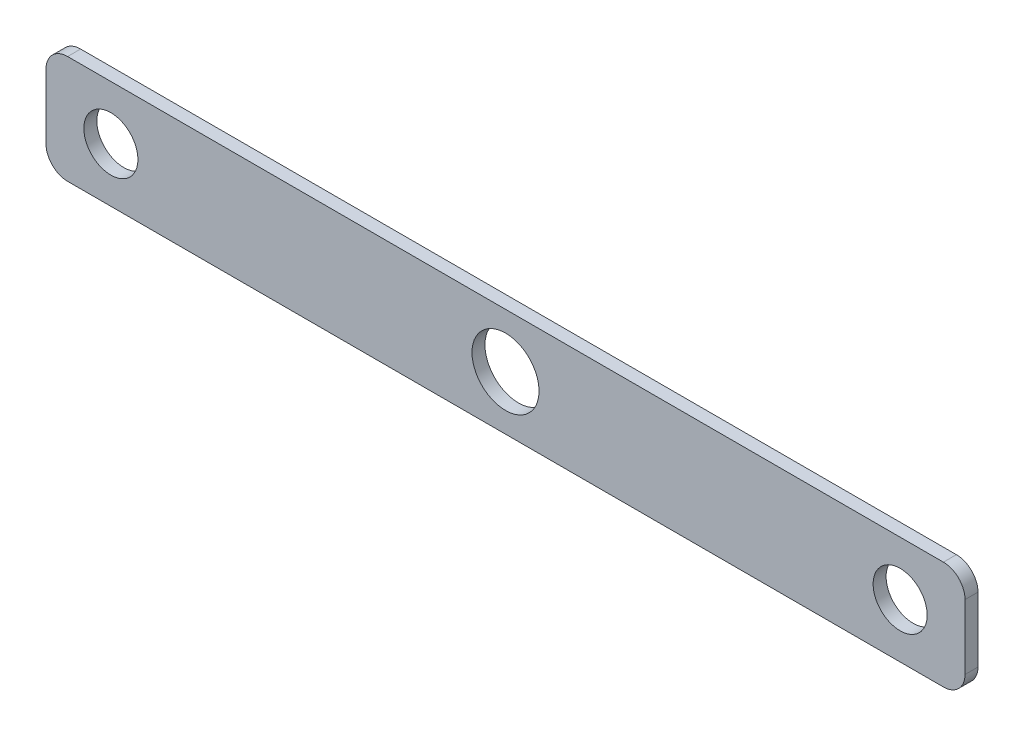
SolidWorks part; units mm, degrees
ref_plane "Front Plane" through (0, 0, 0) normal (0, 0, 1) x (1, 0, 0)
ref_plane "Top Plane" through (0, 0, 0) normal (0, 1, 0) x (1, 0, 0)
ref_plane "Right Plane" through (0, 0, 0) normal (1, 0, 0) x (0, 0, -1)
sketch "Sketch1" plane through (0, 0, 0) normal (0, 0, 1) x (1, 0, 0)
  line L0 (-132.6143, 0) -> (132.6143, 0) construction
  line L1 (0, 50.9398) -> (0, -50.9398) construction
  line L2 (107.95, 12.7) -> (-107.95, 12.7)
  line L3 (107.95, -12.7) -> (107.95, 12.7)
  line L4 (-107.95, -12.7) -> (107.95, -12.7)
  line L5 (-107.95, 12.7) -> (-107.95, -12.7)
  circle A0 centre (92.71, 0) radius 6.35
  circle A1 centre (0, 0) radius 7.874
  circle A2 centre (-92.71, 0) radius 6.35
  dimension "D3" = 12.7
  dimension "D5" = 15.748
  dimension "D1" = 215.9
  dimension "D2" = 25.4
  dimension "D4" = 185.42
extrude "Extrude1" add sketch "Sketch1" along normal mid plane 3.048
fillet "Fillet1" radius 5.08 4 edges at (107.95, 12.7, 0) (107.95, -12.7, 0) (-107.95, -12.7, 0) (-107.95, 12.7, 0)
